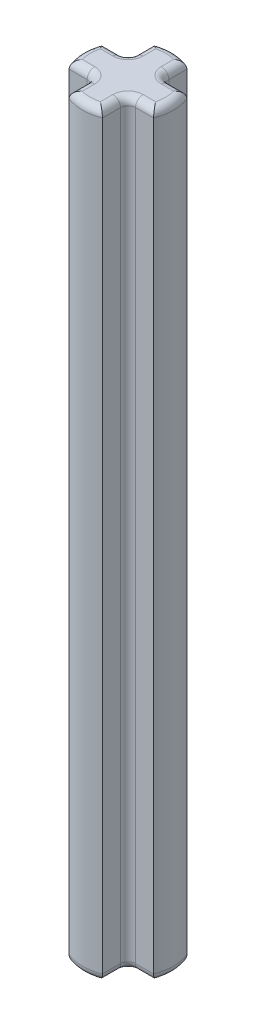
SolidWorks part; units mm, degrees
ref_plane "Front Plane" through (0, 0, 0) normal (0, 0, 1) x (1, 0, 0)
ref_plane "Top Plane" through (0, 0, 0) normal (0, 1, 0) x (1, 0, 0)
ref_plane "Right Plane" through (0, 0, 0) normal (1, 0, 0) x (0, 0, -1)
sketch "Sketch1" plane through (0, 0, 0) normal (0, 1, 0) x (1, 0, 0)
  line L8 (-2.2328, 0.88) -> (-0.88, 0.88)
  line L9 (2.2328, -0.88) -> (0.88, -0.88)
  line L10 (-0.88, 2.2328) -> (-0.88, 0.88)
  line L11 (-0.88, -0.88) -> (-0.88, -2.2328)
  line L12 (0.88, -2.2328) -> (0.88, -0.88)
  line L13 (0.88, 0.88) -> (2.2328, 0.88)
  line L14 (0.88, 0.88) -> (0.88, 2.2328)
  line L15 (-0.88, -0.88) -> (-2.2328, -0.88)
  arc A4 (2.2328, -0.88) -> (2.2328, 0.88) centre (0, 0) ccw
  arc A5 (0.88, 2.2328) -> (-0.88, 2.2328) centre (0, 0) ccw
  arc A6 (-2.2328, 0.88) -> (-2.2328, -0.88) centre (0, 0) ccw
  arc A7 (-0.88, -2.2328) -> (0.88, -2.2328) centre (0, 0) ccw
  dimension "D1" = 0.88
  dimension "D2" = 1.76
  dimension "D3" = 0.88
  dimension "D4" = 1.76
extrude "Boss-Extrude1" add sketch "Sketch1" along normal blind 40
fillet "Fillet7" radius 0.4 28 edges at (-1.5564, 0, -0.88) (-2.4, 0, 0) (-1.5564, 0, 0.88) (-0.88, 0, 1.5564) (0, 0, 2.4) (0.88, 0, 1.5564) (1.5564, 0, 0.88) (2.4, 0, 0) (1.5564, 0, -0.88) (0.88, 0, -1.5564) (0, 0, -2.4) (-0.88, 0, -1.5564) (0, 40, -2.4) (0.88, 40, -1.5564) (1.5564, 40, -0.88) (2.4, 40, 0) (1.5564, 40, 0.88) (0.88, 40, 1.5564) (0, 40, 2.4) (-0.88, 40, 1.5564) (-1.5564, 40, 0.88) (-2.4, 40, 0) (-1.5564, 40, -0.88) (-0.88, 40, -1.5564) (-0.88, 20, -0.88) (0.88, 20, 0.88) (-0.88, 20, 0.88) (0.88, 20, -0.88)
